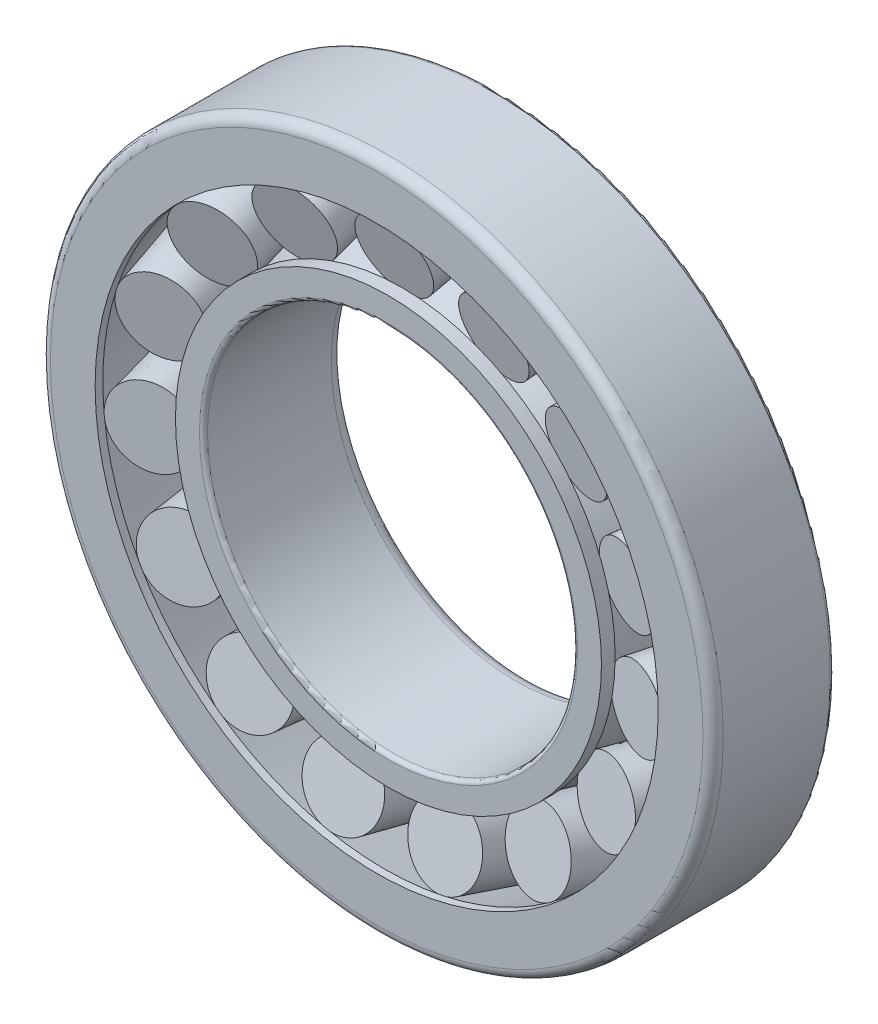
SolidWorks part; units mm, degrees
ref_plane "Front Plane" through (0, 0, 0) normal (0, 0, 1) x (1, 0, 0)
ref_plane "Top Plane" through (0, 0, 0) normal (0, 1, 0) x (1, 0, 0)
ref_plane "Right Plane" through (0, 0, 0) normal (1, 0, 0) x (0, 0, -1)
other "Configuration Table"
sketch "BaseSke" plane through (0, 0, 0) normal (1, 0, 0) x (0, 0, -1)
  line L0 (-47.2296, 0) -> (24.6132, 0) construction
  line L2 (0, 129.5214) -> (0, -86.3012) construction
  line L3 (8.7886, 44.1906) -> (-31.5386, 33.3094) construction
  line L4 (-22.75, 50) -> (-4.75, 50) construction
  line L5 (-21, 27.5) -> (0, 27.5) construction
  line L6 (-11.375, 38.75) -> (-18.4266, 64.8845) construction
  line L7 (-21.6125, 41.8693) -> (-5.8875, 46.5571)
  line L8 (-5.8875, 46.5571) -> (-4.2963, 40.66)
  line L9 (-4.2963, 40.66) -> (-20.1332, 36.3869)
  line L10 (-20.1332, 36.3869) -> (-21.6125, 41.8693)
  line L11 (-22.75, 50) -> (-22.75, 41.85) construction
  line L12 (-21.6073, 41.85) -> (-4.75, 46.8754) construction
  line L13 (-4.75, 50) -> (-4.75, 46.8754) construction
  line L14 (-21.6073, 41.85) -> (-22.75, 41.85) construction
  line L15 (-18.6539, 30.9044) -> (-2.7051, 34.7628) construction
  line L16 (-21, 27.5) -> (-21, 31.6627) construction
  line L17 (-21, 31.6627) -> (-18.9621, 31.6627) construction
  line L18 (0, 35.5211) -> (0, 27.5) construction
  line L19 (-18.9621, 31.6627) -> (-18.7642, 30.9292) construction
  line L20 (-18.7642, 30.9292) -> (-2.6209, 34.8346) construction
  line L21 (-2.6209, 34.8346) -> (-2.8062, 35.5211) construction
  line L22 (-2.8062, 35.5211) -> (0, 35.5211) construction
revolve "Roller" add sketch "BaseSke" angle 360 about L3
sketch "OuterRaceSke" plane through (0, 0, 0) normal (1, 0, 0) x (0, 0, -1)
  line L0 (-21.6073, 41.85) -> (-22.75, 41.85) construction
  line L1 (-21.6073, 41.85) -> (-4.75, 46.8754) construction
  line L2 (-4.75, 50) -> (-4.75, 46.8754) construction
  line L3 (-22.75, 50) -> (-4.75, 50) construction
  line L4 (-22.75, 50) -> (-22.75, 41.85) construction
  line L5 (-21.6073, 41.85) -> (-22.75, 41.85)
  line L6 (-21.6073, 41.85) -> (-4.75, 46.8754)
  line L7 (-4.75, 50) -> (-4.75, 46.8754)
  line L8 (-22.75, 50) -> (-4.75, 50)
  line L9 (-22.75, 50) -> (-22.75, 41.85)
  line L10 (-60.3939, 0) -> (35.9926, 0) construction
revolve "OuterRace" add sketch "OuterRaceSke" angle 360 about L10
sketch "InnerRaceSke" plane through (0, 0, 0) normal (1, 0, 0) x (0, 0, -1)
  line L0 (-21, 27.5) -> (0, 27.5) construction
  line L1 (-21, 27.5) -> (-21, 31.6627) construction
  line L2 (-21, 31.6627) -> (-18.9621, 31.6627) construction
  line L3 (-18.9621, 31.6627) -> (-18.7642, 30.9292) construction
  line L4 (-18.7642, 30.9292) -> (-2.6209, 34.8346) construction
  line L5 (-2.6209, 34.8346) -> (-2.8062, 35.5211) construction
  line L6 (-2.8062, 35.5211) -> (0, 35.5211) construction
  line L7 (0, 35.5211) -> (0, 27.5) construction
  line L8 (-21, 27.5) -> (0, 27.5)
  line L9 (-21, 27.5) -> (-21, 31.6627)
  line L10 (-21, 31.6627) -> (-18.9621, 31.6627)
  line L11 (-18.9621, 31.6627) -> (-18.7642, 30.9292)
  line L12 (-18.7642, 30.9292) -> (-2.6209, 34.8346)
  line L13 (-2.6209, 34.8346) -> (-2.8062, 35.5211)
  line L14 (-2.8062, 35.5211) -> (0, 35.5211)
  line L15 (0, 35.5211) -> (0, 27.5)
  line L16 (-58.1022, 0) -> (39.538, 0) construction
revolve "InnerRace" add sketch "InnerRaceSke" angle 360 about L16
fillet "Fillet1" radius 0.6 2 edges at (50, 0, 4.75) (27.5, 0, 21)
fillet "InnerFillet" radius 2 1 edges at (27.5, 0, 0)
fillet "OuterFillet" radius 1.5 1 edges at (50, 0, 22.75)
pattern_circular "CirPatternBall" count 15 over 360 about axis through (0, 0, 0) along (0, 0, 1) of "Roller"
sketch "Sketch4" plane through (0, 0, 0) normal (1, 0, 0) x (0, 0, -1)
  line L0 (-21.6125, 41.8693) -> (-5.8875, 46.5571)
  line L1 (-5.8875, 46.5571) -> (-2.7051, 34.7628)
  line L2 (-2.7051, 34.7628) -> (-18.6539, 30.9044)
  line L3 (-18.6539, 30.9044) -> (-21.6125, 41.8693)
  line L4 (-40.3293, 0) -> (19.5574, 0) construction
revolve "Simplified" [suppressed] add sketch "Sketch4" angle 360 about L4
equation "\"D2@BaseSke\" = \"Bearing_Thickness@BaseSke\"/2"
equation "\"D3@BaseSke\" =  ( \"Bearing_Outside_Diameter@BaseSke\" + \"Bearing_Inside_Diameter@BaseSke\" )  / 2"
equation "\"Roller_diameter@BaseSke\" = \"D3@BaseSke\"*1.08"
equation "\"D4@BaseSke\" = \"Bearing_Thickness@BaseSke\"/20"
equation "\"D5@BaseSke\" = \"Bearing_Thickness@BaseSke\" / 20"
equation "\"D8@BaseSke\" = \"Bearing_Thickness@BaseSke\"/30"
equation "\"D11@BaseSke\" = \"D8@BaseSke\""
equation "\"D1@CirPatternBall\" = int(  \"D3@BaseSke\" *  pi  /  ( \"Bearing_Outside_Diameter@BaseSke\" - \"Bearing_Inside_Diameter@BaseSke\" )  *2.8 ) "
